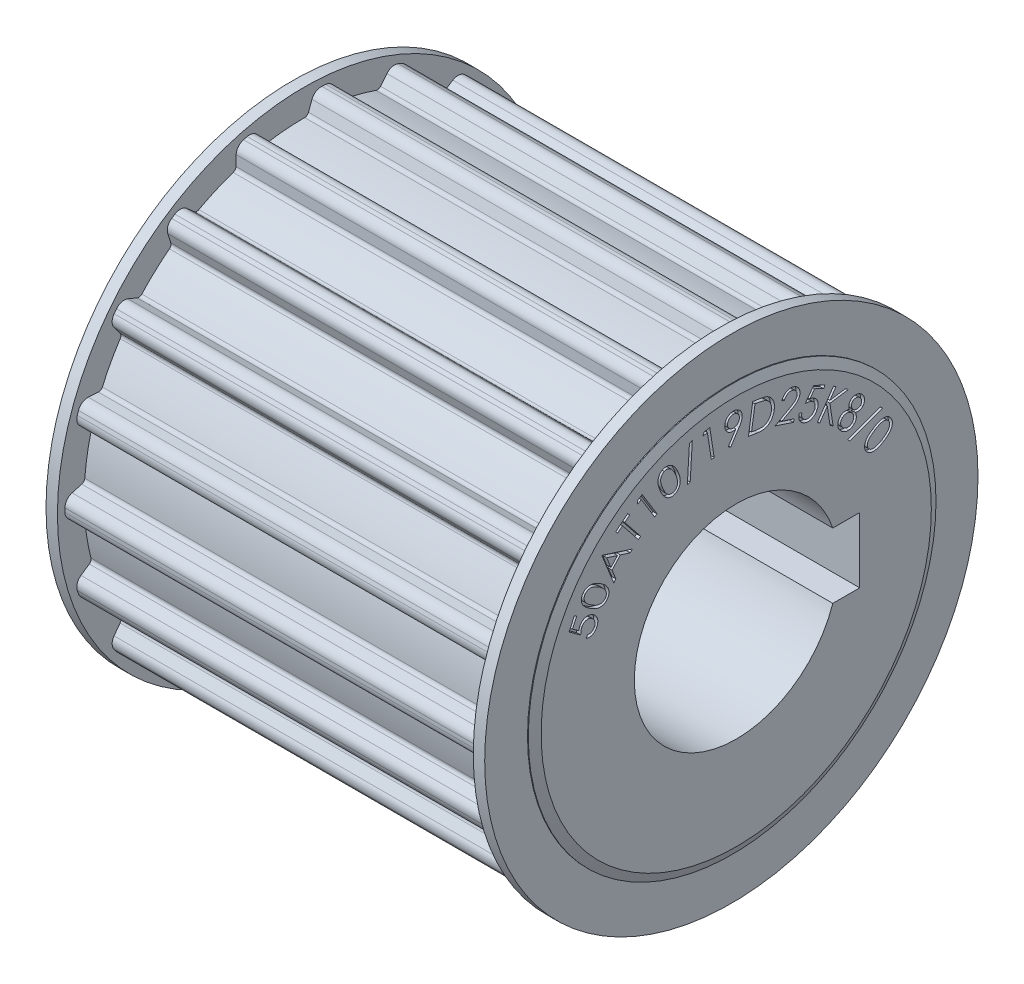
SolidWorks part; units mm, degrees
other "Solid1[1]"
ref_plane "Front Plane" through (0, 0, 0) normal (0, 0, 1) x (1, 0, 0)
ref_plane "Top Plane" through (0, 0, 0) normal (0, 1, 0) x (1, 0, 0)
ref_plane "Right Plane" through (0, 0, 0) normal (1, 0, 0) x (0, 0, -1)
imported_body "Imported1"
other "Move Face1" parameters "D1"=0.4
other "Move Face2" parameters "D1"=0.4
sketch "Sketch2" plane through (-30.15, 0, 0) normal (-1, 0, 0) x (0, 0, 1)
  line L0 (-15.1427, -4) -> (-11.8427, -4)
  line L1 (-15.1427, -4) -> (-15.1427, 4)
  line L2 (-15.1427, 4) -> (-11.8427, 4)
  circle A0 centre (0, 0) radius 25
  arc A1 (-11.8427, -4) -> (-11.8427, 4) centre (0, 0) ccw
extrude "Boss-Extrude1" add sketch "Sketch2" along normal blind 0.6
sketch "Sketch3" plane through (23.65, 0, 0) normal (1, 0, 0) x (0, 0, -1)
  line L0 (15.1427, -4) -> (11.8427, -4)
  line L1 (15.1427, -4) -> (15.1427, 4)
  line L2 (15.1427, 4) -> (11.8427, 4)
  circle A0 centre (0, 0) radius 25
  arc A1 (11.8427, 4) -> (11.8427, -4) centre (0, 0) ccw
extrude "Boss-Extrude2" add sketch "Sketch3" along normal blind 0.6
sketch "Sketch1" plane through (24.25, 0, 0) normal (1, 0, 0) x (0, 0, -1)
  circle A0 centre (0, 0) radius 19 construction
  text T0 "50AT10/19D25K8/0       "
  dimension "D1" = 38
extrude "Cut-Extrude1" cut sketch "Sketch1" against normal blind 0.5
chamfer "Chamfer1" distance 0.5 angle 65 2 edges at (24.25, 0, -25) (-30.75, 0, 25)
